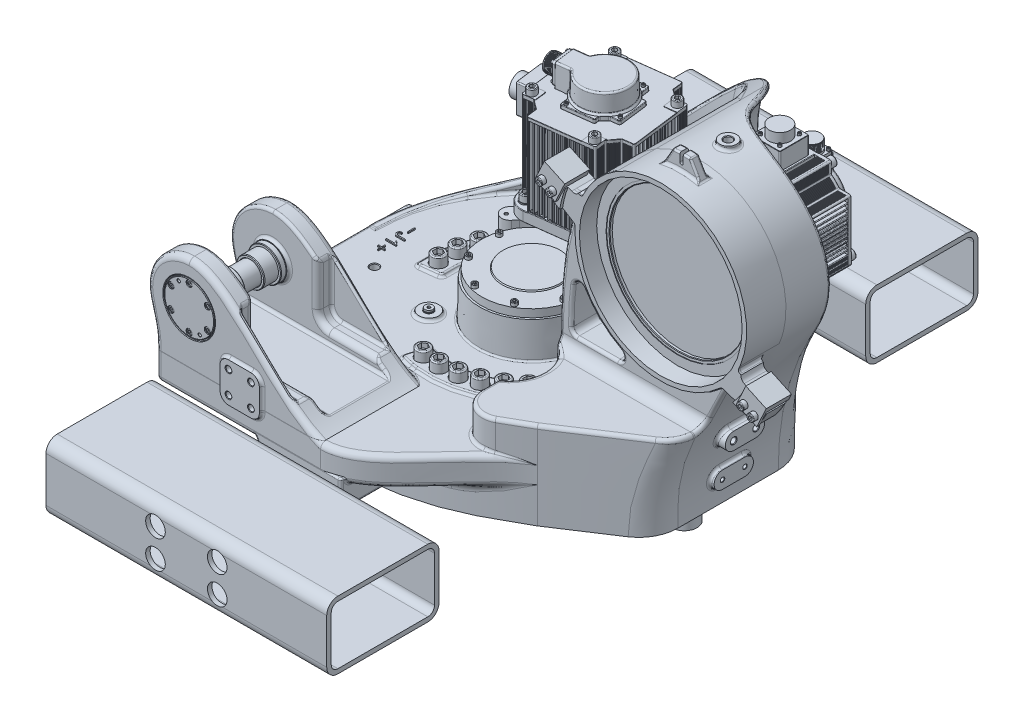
SolidWorks part; units mm, degrees
ref_plane "前视基准面" through (0, 0, 0) normal (0, 0, 1) x (1, 0, 0)
ref_plane "上视基准面" through (0, 0, 0) normal (0, 1, 0) x (1, 0, 0)
ref_plane "右视基准面" through (0, 0, 0) normal (1, 0, 0) x (0, 0, -1)
imported_body "肩部装配-1-solid1"
sketch "草图1" plane through (0, -152.5, 0) normal (0, 1, 0) x (1, 0, 0)
  line L0 (-426.8053, 230.0034) -> (-401.1125, 42.8132)
  line L1 (-401.1125, 42.8132) -> (-213.869, 68.5133)
  line L2 (-426.8053, 230.0034) -> (-239.5618, 255.7035)
  line L3 (-239.5618, 255.7035) -> (-213.869, 68.5133)
surface "曲面-基准面1" sketch "草图1"
split "分割1" trim tools "曲面-基准面1" bodies to split 122 resulting bodies 124 125
sketch "草图2" plane through (0, 0, -13.5) normal (0, 0, -1) x (-1, 0, 0)
  line L1 (-90.4448, 94.1825) -> (90.4448, 94.1825)
  line L2 (-90.4448, 94.1825) -> (-90.4448, -94.1825)
  line L3 (-90.4448, -94.1825) -> (90.4448, -94.1825)
  line L4 (90.4448, 94.1825) -> (90.4448, -94.1825)
  line L5 (-90.4448, 94.1825) -> (90.4448, -94.1825) construction
  line L6 (-90.4448, -94.1825) -> (90.4448, 94.1825) construction
  point P0 (0, 0)
surface "曲面-基准面2" sketch "草图2"
split "分割2" trim tools "曲面-基准面2" bodies to split 124 125 resulting bodies 127 128 129
